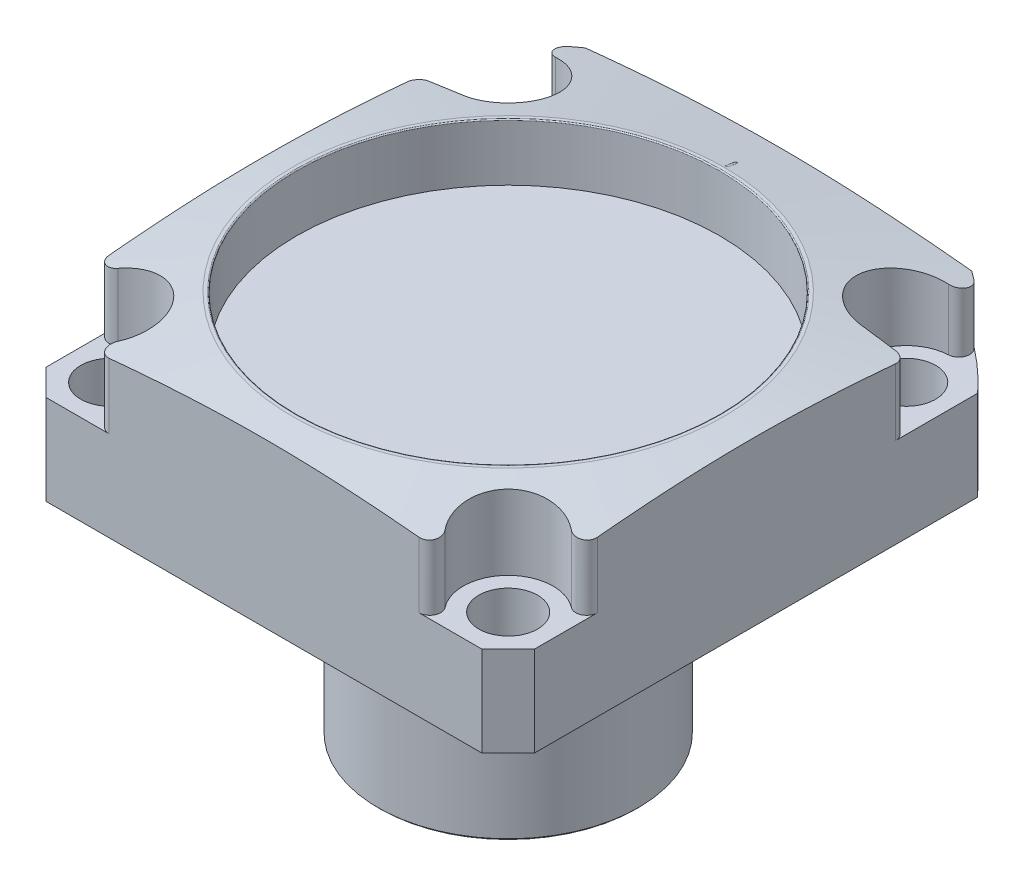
SolidWorks part; units mm, degrees
ref_plane "Front Plane" through (0, 0, 0) normal (0, 0, 1) x (1, 0, 0)
ref_plane "Top Plane" through (0, 0, 0) normal (0, 1, 0) x (1, 0, 0)
ref_plane "Right Plane" through (0, 0, 0) normal (1, 0, 0) x (0, 0, -1)
sketch "Sketch6" plane through (0, 0, 0) normal (0, 0, 1) x (1, 0, 0)
  line L0 (0, -8.9689) -> (0, 71.3762) construction
  line L1 (48.514, 38.6207) -> (49.5046, 38.6207)
  line L2 (49.5046, 38.6207) -> (76.2, 33.9136)
  line L3 (76.2, 33.9136) -> (76.2, 0)
  line L4 (76.2, 0) -> (29.8831, 0)
  line L5 (29.8831, 0) -> (29.8831, -49.3903)
  line L6 (29.8831, -49.3903) -> (0, -49.3903)
  line L7 (0, -49.3903) -> (0, 25.5007)
  line L8 (48.514, 38.6207) -> (48.514, 25.5007)
  line L9 (48.514, 25.5007) -> (0, 25.5007)
  dimension "D1" = 59.7662
  dimension "D2" = 38.6207
  dimension "D3" = 49.3903
  dimension "D4" = 152.4
  dimension "D5" = 10
  dimension "D6" = 99.0092
  dimension "D7" = 13.12
  dimension "D8" = 97.028
  dimension "D9" = 88.011
  dimension "D10" = 4.7071
revolve "Revolve3" add sketch "Sketch6" angle 360 about L0
fillet "Fillet7" radius 0.254 1 edges at (0, 38.6207, -48.514)
sketch "Sketch7" plane through (0, 0, 0) normal (0, -1, 0) x (1, 0, 0)
  line L0 (0, 0) -> (0, -52.3237) construction
  line L1 (-50, 56) -> (50, 56)
  line L2 (-56, 50) -> (-56, -62)
  line L3 (-56, -62) -> (56, -62)
  line L4 (56, 50) -> (56, -62)
  line L5 (50, 56) -> (56, 50)
  line L6 (-56, 50) -> (-50, 56)
  point P0 (-56, 56)
  point P3 (56, 56)
  dimension "D1" = 112
  dimension "D2" = 118
  dimension "D3" = 56
  dimension "D4" = 62
  dimension "D5" = 56
extrude "Cut-Extrude5" cut sketch "Sketch7" against normal through all flip side to cut
sketch "Sketch8" plane through (0, 0, 0) normal (0, -1, 0) x (1, 0, 0)
  circle A0 centre (-45.6438, 45.6438) radius 6.7437
  dimension "D1" = 13.4874
  dimension "D2" = 45.6438
  dimension "D3" = 45.6438
extrude "Cut-Extrude6" cut sketch "Sketch8" against normal through all
pattern_circular "CirPattern2" count 4 over 360 about axis through (0, 0, 0) along (0, 1, 0) of "Cut-Extrude6"
sketch "Sketch9" plane through (0, 38.6207, 0) normal (0, 1, 0) x (1, 0, 0)
  line L0 (-56, -50) -> (-50, -56) construction
  line L1 (-50, -56) -> (50, -56) construction
  line L2 (56, 55.9689) -> (56, 35.3187)
  line L3 (-56, -50) -> (-50, -56)
  line L4 (56, 35.3187) -> (45.6438, 35.3187)
  line L5 (45.6438, 55.9689) -> (56, 55.9689)
  line L6 (-45.6438, 55.9689) -> (-56, 55.9689)
  line L7 (-56, 51.6763) -> (-56, -50) construction
  line L8 (-56, 35.3187) -> (-45.6438, 35.3187)
  line L9 (-56, 55.9689) -> (-56, 35.3187)
  line L10 (-50, -56) -> (-41.3981, -56)
  line L11 (0, 0) -> (0, 26.6366) construction
  line L13 (-56, -41.3981) -> (-52.9447, -38.3429)
  line L14 (-38.3429, -52.9447) -> (-41.3981, -56)
  line L15 (-56, -41.3981) -> (-56, -50)
  line L16 (56, -41.3981) -> (56, -50)
  line L17 (38.3429, -52.9447) -> (41.3981, -56)
  line L18 (56, -41.3981) -> (52.9448, -38.3429)
  line L19 (50, -56) -> (41.3981, -56)
  line L20 (56, -50) -> (50, -56)
  arc A0 (-38.3429, -52.9447) -> (-52.9447, -38.3429) centre (-45.6438, -45.6438) ccw
  arc A1 (-45.6438, 35.3187) -> (-45.6438, 55.9689) centre (-45.6438, 45.6438) ccw
  arc A2 (38.3429, -52.9447) -> (52.9448, -38.3429) centre (45.6438, -45.6438) cw
  arc A3 (45.6438, 35.3187) -> (45.6438, 55.9689) centre (45.6438, 45.6438) cw
  dimension "D1" = 20.6502
extrude "Cut-Extrude7" cut sketch "Sketch9" against normal offset from surface (17.9705 mm away) 20.6502
fillet "Fillet4" radius 2.4892 8 edges at (-56, 28.1629, -35.3187) (41.3981, 27.8602, 56) (-41.3981, 27.8602, 56) (-56, 27.8602, 41.3981) (51.71, 27.2819, -55.9689) (-51.71, 27.2819, -55.9689)
fillet "Fillet5" radius 0.4 1 edges at (0, 0, -29.8831)
chamfer "Chamfer2" distance 0.5 angle 45 1 edges at (0, -49.3903, -29.8831)
ref_plane "Plane1" through (0, 18.6436, 0) normal (0, -1, 0) x (1, 0, 0)
sketch "Sketch11" plane through (0, 18.6436, 0) normal (0, -1, 0) x (1, 0, 0)
  line L0 (-20, -4.7006) -> (-20, -58.3255) construction
  line L1 (-44.2994, -62) -> (44.2994, -62) construction
  line L2 (-26.1849, -61.75) -> (-25.6396, -59.1846)
  line L3 (-25.6396, -59.1846) -> (-24.9784, -58.5234)
  line L10 (-20, -62) -> (-30.4775, -62)
  line L11 (-20, -42.7) -> (-20, -62)
  line L12 (-24.9784, -42.7) -> (-20, -42.7)
  line L13 (-24.9784, -58.5234) -> (-24.9784, -42.7)
  line L15 (-30.4775, -61.75) -> (-26.1849, -61.75)
  line L16 (-30.4775, -62) -> (-30.4775, -61.75)
  dimension "D1" = 20
  dimension "D2" = 0.25
  dimension "D3" = 19.05
  dimension "D4" = 9.9568
  dimension "D5" = 20.955
  dimension "D6" = 12
  dimension "D7" = 12.3698
  dimension "D8" = 45
  dimension "D9" = 2.5654
revolve "Cut-Revolve5" cut sketch "Sketch11" angle 360 about L0
ref_plane "Plane2" through (0, 0, -52.7558) normal (0, 0, 1) x (1, 0, 0)
sketch "Sketch13" plane through (0, 0, -52.7558) normal (0, 0, 1) x (1, 0, 0)
  line L0 (-23.4442, 17.653) -> (-23.4442, 5.3993)
  line L1 (-24.5618, 2.6416) -> (-24.1191, 4.7244)
  line L2 (-24.5618, 2.6416) -> (-27.9273, 2.6416)
  line L3 (-27.9273, 2.6416) -> (-27.9273, 0)
  line L4 (-30.2831, 0) -> (30.2831, 0) construction
  line L5 (-27.9273, 0) -> (-19.9898, 0)
  line L6 (-19.9898, 0) -> (-19.9898, 17.653)
  line L7 (-19.9898, 17.653) -> (-23.4442, 17.653)
  line L8 (-19.9898, 15.2099) -> (-19.9898, -4.3918) construction
  line L9 (-24.1191, 4.7244) -> (-23.4442, 5.3993)
  dimension "D1" = 19.9898
  dimension "D2" = 6.9088
  dimension "D3" = 15.0114
  dimension "D4" = 2.6416
  dimension "D5" = 15.875
  dimension "D6" = 45
  dimension "D7" = 2.0828
  dimension "D8" = 12
  dimension "D9" = 9.144
revolve "Cut-Revolve6" cut sketch "Sketch13" angle 360 about L8
mirror "Mirror4" about plane through (0, 0, 0) normal (1, 0, 0) of "Cut-Revolve5", "Cut-Revolve6"
sketch "Sketch16" plane through (0, 0, -52.7558) normal (0, 0, 1) x (1, 0, 0)
  line L0 (-24.5618, 0.8763) -> (-24.5618, -0.889) construction
  line L1 (-19.9898, 9.3219) -> (-19.9898, -15.1063) construction
  line L2 (-19.9898, 5.3993) -> (-19.9898, 15.0685) construction
  line L4 (-24.5618, -0.889) -> (-26.3271, -0.889) construction
  line L5 (-24.5618, 2.6416) -> (-15.4178, 2.6416) construction
  circle A0 centre (-26.3271, 0.8763) radius 1.7653
  dimension "D1" = 3.5306
  dimension "D3" = 1.7653
  dimension "D2" = 4.572
revolve "Revolve7" add sketch "Sketch16" angle 360 about L1
mirror "Mirror3" about plane through (0, 0, 0) normal (1, 0, 0)
sketch "Sketch17" plane through (0, 0, 0) normal (1, 0, 0) x (0, 0, -1)
  line L0 (40.1487, 41.0421) -> (43.5332, 40.4453) construction
  line L1 (62, 36.4174) -> (49.5046, 38.6207) construction
  line L2 (49.997, 38.5339) -> (51.9666, 38.1866) construction
  line L3 (50.375, 39.239) -> (52.3446, 38.8917) construction
  line L5 (50.2361, 38.4511) -> (52.2057, 38.1038)
  line L6 (49.5871, 39.3779) -> (53.1324, 38.7527)
  arc A0 (49.5871, 39.3779) -> (50.2361, 38.4511) centre (50.375, 39.239) ccw
  arc A1 (52.2057, 38.1038) -> (53.1324, 38.7527) centre (52.3446, 38.8917) ccw
  dimension "D1" = 1.6
  dimension "D2" = 2
  dimension "D3" = 0.5
  dimension "D4" = 0.76
  dimension "D5" = 0.04
revolve "Cut-Revolve7" cut sketch "Sketch17" angle 360 about L6
equation "\"D3@Sketch7\"=\"D5@Sketch7\""
equation "\"D2@Sketch8\"=\"D3@Sketch8\""
equation "\"D3@Sketch16\"=\"D1@Sketch16\"/2"
